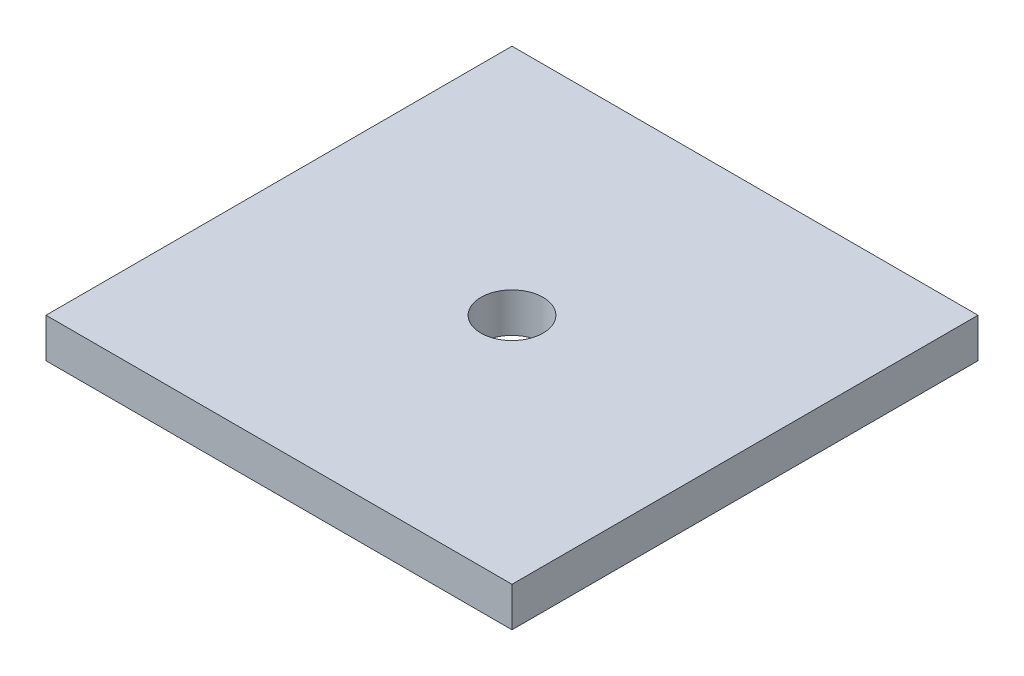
SolidWorks part; units mm, degrees
ref_plane "Front Plane" through (0, 0, 0) normal (0, 0, 1) x (1, 0, 0)
ref_plane "Top Plane" through (0, 0, 0) normal (0, 1, 0) x (1, 0, 0)
ref_plane "Right Plane" through (0, 0, 0) normal (1, 0, 0) x (0, 0, -1)
sketch "Sketch1" plane through (0, 0, 0) normal (0, 1, 0) x (1, 0, 0)
  line L1 (-37.5, 37.5) -> (37.5, 37.5)
  line L2 (-37.5, 37.5) -> (-37.5, -37.5)
  line L3 (-37.5, -37.5) -> (37.5, -37.5)
  line L4 (37.5, 37.5) -> (37.5, -37.5)
  line L5 (-37.5, 37.5) -> (37.5, -37.5) construction
  line L6 (-37.5, -37.5) -> (37.5, 37.5) construction
  point P0 (0, 0)
  dimension "D1" = 75
extrude "Boss-Extrude1" add sketch "Sketch1" along normal blind 6.35
hole_wizard "Ø10.0 (10) Diameter Hole1" positions "Sketch3" profile "Sketch2" hole size "Ø10.0" standard "Ansi Metric"
sketch "Sketch3" plane through (0, 6.35, 0) normal (0, 1, 0) x (-1, 0, 0)
  point P0 (0, 0)
sketch "Sketch2" plane through (0, 6.35, 0) normal (1, 0, 0) x (0, 0, 1)
  line L0 (0, 0) -> (0, 6.35)
  line L1 (0, 6.35) -> (5, 6.35)
  line L2 (5, 6.35) -> (5, 0)
  line L5 (5, 0) -> (0, 0)
  line L11 (0, -6.35) -> (0, 107.95) construction
  dimension "Thru Hole Dia." = 10
  dimension "Thru Hole Depth" = 6.35
